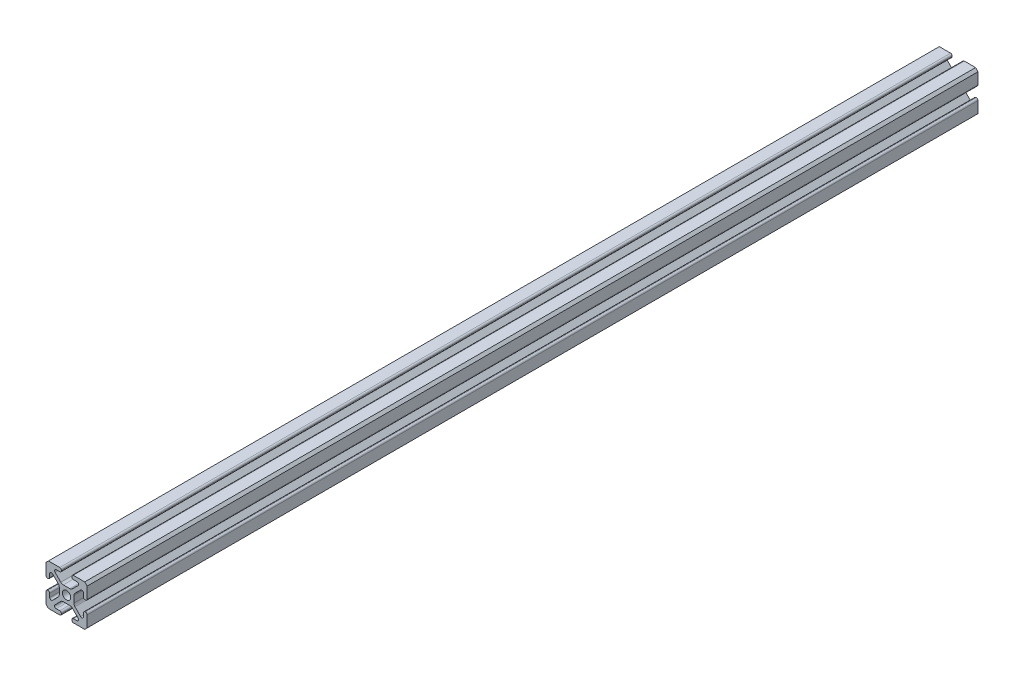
SolidWorks part; units mm, degrees
ref_plane "Front Plane" through (0, 0, 0) normal (0, 0, 1) x (1, 0, 0)
ref_plane "Top Plane" through (0, 0, 0) normal (0, 1, 0) x (1, 0, 0)
ref_plane "Right Plane" through (0, 0, 0) normal (1, 0, 0) x (0, 0, -1)
other "Configuration Table"
sketch "Sketch1" plane through (0, 0, 0) normal (0, 0, 1) x (1, 0, 0)
  line L0 (-11.2, -12.7) -> (-4.2223, -12.7)
  line L1 (-3.2063, -11.684) -> (-3.2063, -11.4407)
  line L2 (-4.2223, -10.4247) -> (-6.4093, -10.4247)
  line L3 (-7.1277, -8.6902) -> (-3.5932, -5.1557)
  line L4 (-2.0306, -4.5085) -> (2.0306, -4.5085)
  line L5 (3.5932, -5.1557) -> (7.1277, -8.6902)
  line L6 (6.4093, -10.4247) -> (4.2223, -10.4247)
  line L7 (3.2063, -11.4407) -> (3.2063, -11.684)
  line L8 (4.2223, -12.7) -> (11.2, -12.7)
  line L9 (11.2, -12.7) -> (12.7, -11.2)
  line L10 (12.7, -11.2) -> (12.7, -4.2223)
  line L11 (11.684, -3.2063) -> (11.4407, -3.2063)
  line L12 (10.4247, -4.2223) -> (10.4247, -6.4093)
  line L13 (8.6902, -7.1277) -> (5.1557, -3.5932)
  line L14 (4.5085, -2.0306) -> (4.5085, 2.0306)
  line L15 (5.1557, 3.5932) -> (8.6902, 7.1277)
  line L16 (10.4247, 6.4093) -> (10.4247, 4.2223)
  line L17 (11.4407, 3.2063) -> (11.684, 3.2063)
  line L18 (12.7, 4.2223) -> (12.7, 11.2)
  line L19 (12.7, 11.2) -> (11.2, 12.7)
  line L20 (11.2, 12.7) -> (4.2223, 12.7)
  line L21 (3.2063, 11.684) -> (3.2063, 11.4407)
  line L22 (4.2223, 10.4247) -> (6.4093, 10.4247)
  line L23 (7.1277, 8.6902) -> (3.5932, 5.1557)
  line L24 (2.0306, 4.5085) -> (-2.0306, 4.5085)
  line L25 (-3.5932, 5.1557) -> (-7.1277, 8.6902)
  line L26 (-6.4093, 10.4247) -> (-4.2223, 10.4247)
  line L27 (-3.2063, 11.4407) -> (-3.2063, 11.684)
  line L28 (-4.2223, 12.7) -> (-11.2, 12.7)
  line L29 (-11.2, 12.7) -> (-12.7, 11.2)
  line L30 (-12.7, 11.2) -> (-12.7, 4.2223)
  line L31 (-11.684, 3.2063) -> (-11.4407, 3.2063)
  line L32 (-10.4247, 4.2223) -> (-10.4247, 6.4093)
  line L33 (-8.6902, 7.1277) -> (-5.1557, 3.5932)
  line L34 (-4.5085, 2.0306) -> (-4.5085, -2.0306)
  line L35 (-5.1557, -3.5932) -> (-8.6902, -7.1277)
  line L36 (-10.4247, -6.4093) -> (-10.4247, -4.2223)
  line L37 (-11.4407, -3.2063) -> (-11.684, -3.2063)
  line L38 (-12.7, -4.2223) -> (-12.7, -11.2)
  line L39 (-12.7, -11.2) -> (-11.2, -12.7)
  arc A0 (-2.555, 0) -> (2.555, 0) centre (0, 0) ccw
  arc A1 (2.555, 0) -> (-2.555, 0) centre (0, 0) ccw
  arc A2 (-4.2223, -12.7) -> (-3.2063, -11.684) centre (-4.2223, -11.684) ccw
  arc A3 (-3.2063, -11.4407) -> (-4.2223, -10.4247) centre (-4.2223, -11.4407) ccw
  arc A4 (-7.1277, -8.6902) -> (-6.4093, -10.4247) centre (-6.4093, -9.4087) ccw
  arc A5 (-2.0306, -4.5085) -> (-3.5932, -5.1557) centre (-2.0306, -6.7183) ccw
  arc A6 (3.5932, -5.1557) -> (2.0306, -4.5085) centre (2.0306, -6.7183) ccw
  arc A7 (7.4253, -9.4087) -> (7.1277, -8.6902) centre (6.4093, -9.4087) ccw
  arc A8 (6.4093, -10.4247) -> (7.4253, -9.4087) centre (6.4093, -9.4087) ccw
  arc A9 (4.2223, -10.4247) -> (3.2063, -11.4407) centre (4.2223, -11.4407) ccw
  arc A10 (3.2063, -11.684) -> (4.2223, -12.7) centre (4.2223, -11.684) ccw
  arc A11 (12.7, -4.2223) -> (11.684, -3.2063) centre (11.684, -4.2223) ccw
  arc A12 (11.4407, -3.2063) -> (10.4247, -4.2223) centre (11.4407, -4.2223) ccw
  arc A13 (8.6902, -7.1277) -> (10.4247, -6.4093) centre (9.4087, -6.4093) ccw
  arc A14 (4.5085, -2.0306) -> (5.1557, -3.5932) centre (6.7183, -2.0306) ccw
  arc A15 (5.1557, 3.5932) -> (4.5085, 2.0306) centre (6.7183, 2.0306) ccw
  arc A16 (9.4087, 7.4253) -> (8.6902, 7.1277) centre (9.4087, 6.4093) ccw
  arc A17 (10.4247, 6.4093) -> (9.4087, 7.4253) centre (9.4087, 6.4093) ccw
  arc A18 (10.4247, 4.2223) -> (11.4407, 3.2063) centre (11.4407, 4.2223) ccw
  arc A19 (11.684, 3.2063) -> (12.7, 4.2223) centre (11.684, 4.2223) ccw
  arc A20 (4.2223, 12.7) -> (3.2063, 11.684) centre (4.2223, 11.684) ccw
  arc A21 (3.2063, 11.4407) -> (4.2223, 10.4247) centre (4.2223, 11.4407) ccw
  arc A22 (7.1277, 8.6902) -> (6.4093, 10.4247) centre (6.4093, 9.4087) ccw
  arc A23 (2.0306, 4.5085) -> (3.5932, 5.1557) centre (2.0306, 6.7183) ccw
  arc A24 (-3.5932, 5.1557) -> (-2.0306, 4.5085) centre (-2.0306, 6.7183) ccw
  arc A25 (-7.4253, 9.4087) -> (-7.1277, 8.6902) centre (-6.4093, 9.4087) ccw
  arc A26 (-6.4093, 10.4247) -> (-7.4253, 9.4087) centre (-6.4093, 9.4087) ccw
  arc A27 (-4.2223, 10.4247) -> (-3.2063, 11.4407) centre (-4.2223, 11.4407) ccw
  arc A28 (-3.2063, 11.684) -> (-4.2223, 12.7) centre (-4.2223, 11.684) ccw
  arc A29 (-12.7, 4.2223) -> (-11.684, 3.2063) centre (-11.684, 4.2223) ccw
  arc A30 (-11.4407, 3.2063) -> (-10.4247, 4.2223) centre (-11.4407, 4.2223) ccw
  arc A31 (-8.6902, 7.1277) -> (-10.4247, 6.4093) centre (-9.4087, 6.4093) ccw
  arc A32 (-4.5085, 2.0306) -> (-5.1557, 3.5932) centre (-6.7183, 2.0306) ccw
  arc A33 (-5.1557, -3.5932) -> (-4.5085, -2.0306) centre (-6.7183, -2.0306) ccw
  arc A34 (-9.4087, -7.4253) -> (-8.6902, -7.1277) centre (-9.4087, -6.4093) ccw
  arc A35 (-10.4247, -6.4093) -> (-9.4087, -7.4253) centre (-9.4087, -6.4093) ccw
  arc A36 (-10.4247, -4.2223) -> (-11.4407, -3.2063) centre (-11.4407, -4.2223) ccw
  arc A37 (-11.684, -3.2063) -> (-12.7, -4.2223) centre (-11.684, -4.2223) ccw
extrude "Boss-Extrude1" add sketch "Sketch1" along normal blind 550
equation "\"Extrusion Length\"= 24"
